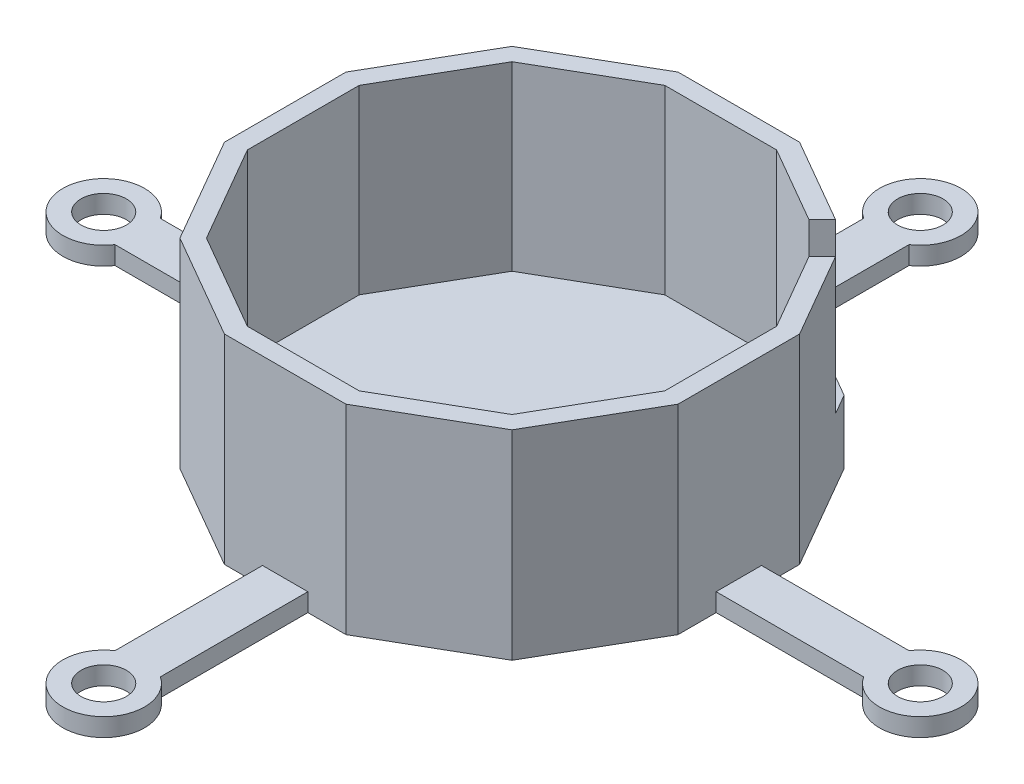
SolidWorks part; units mm, degrees
ref_plane "Front Plane" through (0, 0, 0) normal (0, 0, 1) x (1, 0, 0)
ref_plane "Top Plane" through (0, 0, 0) normal (0, 1, 0) x (1, 0, 0)
ref_plane "Right Plane" through (0, 0, 0) normal (1, 0, 0) x (0, 0, -1)
sketch "Sketch5" plane through (0, 0, 0) normal (0, 1, 0) x (1, 0, 0)
  line L1 (24, 6.4308) -> (17.5692, 17.5692) construction
  line L2 (17.5692, 17.5692) -> (6.4308, 24) construction
  line L3 (6.4308, 24) -> (-6.4308, 24) construction
  line L4 (-6.4308, 24) -> (-17.5692, 17.5692) construction
  line L5 (-17.5692, 17.5692) -> (-24, 6.4308) construction
  line L6 (-24, 6.4308) -> (-24, -6.4308) construction
  line L7 (-24, -6.4308) -> (-17.5692, -17.5692) construction
  line L8 (-17.5692, -17.5692) -> (-6.4308, -24) construction
  line L9 (-6.4308, -24) -> (6.4308, -24) construction
  line L10 (6.4308, -24) -> (17.5692, -17.5692) construction
  line L11 (17.5692, -17.5692) -> (24, -6.4308) construction
  line L12 (24, -6.4308) -> (24, 6.4308) construction
  line L13 (25, 6.6987) -> (18.3013, 18.3013)
  line L14 (18.3013, 18.3013) -> (6.6987, 25)
  line L16 (-6.6987, 25) -> (-18.3013, 18.3013)
  line L17 (-18.3013, 18.3013) -> (-25, 6.6987)
  line L19 (-25, -6.6987) -> (-18.3013, -18.3013)
  line L20 (-18.3013, -18.3013) -> (-6.6987, -25)
  line L22 (6.6987, -25) -> (18.3013, -18.3013)
  line L23 (18.3013, -18.3013) -> (25, -6.6987)
  line L24 (23, -6.1628) -> (23, 6.1628) construction
  line L25 (23, 6.1628) -> (16.8372, 16.8372) construction
  line L26 (16.8372, 16.8372) -> (6.1628, 23) construction
  line L27 (6.1628, 23) -> (-6.1628, 23) construction
  line L28 (-6.1628, 23) -> (-16.8372, 16.8372) construction
  line L29 (-16.8372, 16.8372) -> (-23, 6.1628) construction
  line L30 (-23, 6.1628) -> (-23, -6.1628) construction
  line L31 (-23, -6.1628) -> (-16.8372, -16.8372) construction
  line L32 (-16.8372, -16.8372) -> (-6.1628, -23) construction
  line L33 (-6.1628, -23) -> (6.1628, -23) construction
  line L34 (6.1628, -23) -> (16.8372, -16.8372) construction
  line L35 (16.8372, -16.8372) -> (23, -6.1628) construction
  line L36 (0, 0) -> (45, 0) construction
  line L37 (25, 0) -> (41.2583, 0) construction
  line L38 (25, -2.5) -> (41.2583, -2.5)
  line L39 (25, 2.5) -> (41.2583, 2.5)
  line L40 (2.5, -25) -> (2.5, -41.2583)
  line L41 (-2.5, -25) -> (-2.5, -41.2583)
  line L42 (-25, -2.5) -> (-41.2583, -2.5)
  line L43 (-25, 2.5) -> (-41.2583, 2.5)
  line L44 (-2.5, 25) -> (-2.5, 41.2583)
  line L45 (2.5, 25) -> (2.5, 41.2583)
  line L46 (25, -6.6987) -> (25, 6.6987) construction
  line L47 (25, 6.6987) -> (25, 2.5)
  line L48 (25, -2.5) -> (25, -6.6987)
  line L49 (-6.6987, -25) -> (-2.5, -25)
  line L50 (6.6987, 25) -> (-6.6987, 25) construction
  line L51 (-25, 6.6987) -> (-25, -6.6987) construction
  line L52 (-6.6987, -25) -> (6.6987, -25) construction
  line L53 (2.5, -25) -> (6.6987, -25)
  line L54 (-6.6987, 25) -> (-2.5, 25)
  line L55 (2.5, 25) -> (6.6987, 25)
  line L56 (-25, 2.5) -> (-25, 6.6987)
  line L57 (-25, -2.5) -> (-25, -6.6987)
  circle A0 centre (0, 0) radius 24 construction
  circle A1 centre (45, 0) radius 4.5 construction
  circle A2 centre (45, 0) radius 2.5 construction
  arc A3 (41.2583, -2.5) -> (41.2583, 2.5) centre (45, 0) ccw
  arc A4 (-2.5, -41.2583) -> (2.5, -41.2583) centre (0, -45) ccw
  circle A5 centre (0, -45) radius 2.5 construction
  circle A6 centre (0, -45) radius 4.5 construction
  arc A7 (-41.2583, 2.5) -> (-41.2583, -2.5) centre (-45, 0) ccw
  circle A8 centre (-45, 0) radius 2.5 construction
  circle A9 centre (-45, 0) radius 4.5 construction
  arc A10 (2.5, 41.2583) -> (-2.5, 41.2583) centre (0, 45) ccw
  circle A11 centre (0, 45) radius 2.5 construction
  circle A12 centre (0, 45) radius 4.5 construction
  point P1 (24, 0)
  point P77 (0, 0)
  dimension "D4" = 9
  dimension "D5" = 5
  dimension "D6" = 45
  dimension "D10" = 45
  dimension "D11" = 25
  dimension "D2" = 1
  dimension "D3" = 1
  dimension "D7" = 2.5
  dimension "D8" = 2.5
  dimension "D9" = 4
extrude "Sensor Block" add sketch "Sketch5" along normal blind 22
ref_plane "Plane1" through (0, 22, 0) normal (0, 1, 0) x (1, 0, 0)
sketch "Sketch3" plane through (0, 22, 0) normal (0, 1, 0) x (1, 0, 0)
  line L0 (0, 0) -> (4.3131, 0) construction
  line L1 (18.9778, 18.9778) -> (16.1607, 16.1607) construction
  line L2 (17.9398, 14.4042) -> (20.7455, 17.21)
  line L3 (14.3816, 17.9171) -> (17.21, 20.7455)
  line L6 (17.21, 20.7455) -> (20.7455, 17.21)
  line L7 (17.9398, 14.4042) -> (14.3816, 17.9171)
  point P9 (17.5692, 17.5692)
  dimension "D1" = 5
  dimension "D4" = 89.633
  dimension "D2" = 4
  dimension "D3" = 22.8546
sketch "Sketch7" plane through (0, 22, 0) normal (0, 1, 0) x (1, 0, 0)
  line L0 (25, 6.6987) -> (25, -6.6987)
  line L1 (23, 6.1628) -> (16.8372, 16.8372)
  line L2 (16.8372, 16.8372) -> (6.1628, 23)
  line L3 (6.1628, 23) -> (-6.1628, 23)
  line L4 (-6.1628, 23) -> (-16.8372, 16.8372)
  line L5 (-16.8372, 16.8372) -> (-23, 6.1628)
  line L6 (-23, 6.1628) -> (-23, -6.1628)
  line L7 (-23, -6.1628) -> (-16.8372, -16.8372)
  line L8 (-16.8372, -16.8372) -> (-6.1628, -23)
  line L9 (-6.1628, -23) -> (6.1628, -23)
  line L10 (6.1628, -23) -> (16.8372, -16.8372)
  line L11 (16.8372, -16.8372) -> (23, -6.1628)
  line L12 (23, -6.1628) -> (23, 6.1628)
  line L25 (25, -6.6987) -> (50.2754, -6.6987)
  line L26 (50.2754, -6.6987) -> (50.2754, 6.6987)
  line L27 (50.2754, 6.6987) -> (25, 6.6987)
  line L28 (-6.6987, 25) -> (6.6987, 25)
  line L29 (6.6987, 25) -> (6.6987, 51.7583)
  line L30 (6.6987, 51.7583) -> (-6.6987, 51.7583)
  line L31 (-6.6987, 51.7583) -> (-6.6987, 25)
  line L32 (-25, 6.6987) -> (-25, -6.6987)
  line L33 (-25, -6.6987) -> (-51.3901, -6.6987)
  line L34 (-51.3901, -6.6987) -> (-51.3901, 6.6987)
  line L35 (-51.3901, 6.6987) -> (-25, 6.6987)
  line L36 (-6.6987, -25) -> (6.6987, -25)
  line L37 (6.6987, -25) -> (6.6987, -50.9619)
  line L38 (6.6987, -50.9619) -> (-6.6987, -50.9619)
  line L39 (-6.6987, -50.9619) -> (-6.6987, -25)
  circle A0 centre (0, 0) radius 23 construction
  dimension "D2" = 23
  dimension "D1" = 25.2754
  dimension "D3" = 25.9619
  dimension "D4" = 26.3901
  dimension "D5" = 26.7583
extrude "Sensor Base Cut" cut sketch "Sketch7" against normal blind 20
extrude "Wire Slot" cut sketch "Sketch3" against normal blind 15
sketch "Sketch8" plane through (0, 0, 0) normal (0, 1, 0) x (1, 0, 0)
  circle A0 centre (45, 0) radius 2.5
  circle A1 centre (0, 45) radius 2.5
  circle A2 centre (0, -45) radius 2.5
  circle A3 centre (-45, 0) radius 2.5
  dimension "D1" = 5
  dimension "D2" = 5
  dimension "D3" = 5
  dimension "D4" = 5
extrude "Mount Holes" cut sketch "Sketch8" along normal blind 2
